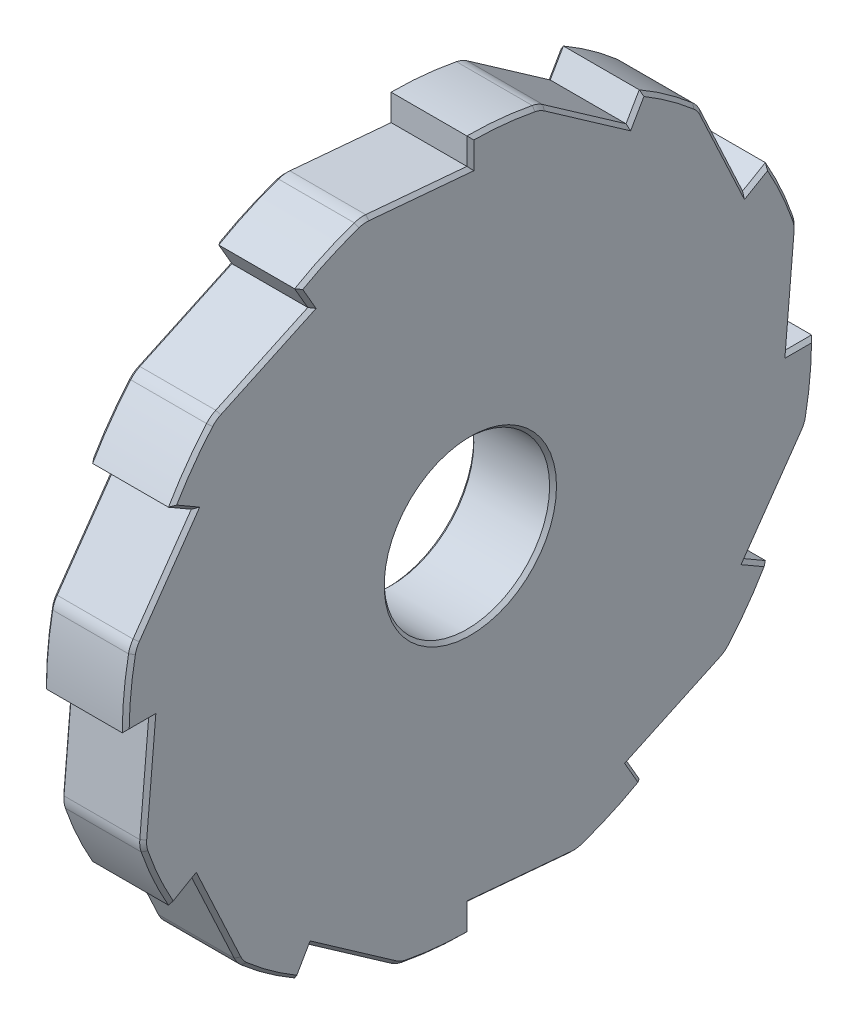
SolidWorks part; units mm, degrees
ref_plane "Спереди" through (0, 0, 0) normal (0, 0, 1) x (1, 0, 0)
ref_plane "Сверху" through (0, 0, 0) normal (0, 1, 0) x (1, 0, 0)
ref_plane "Справа" through (0, 0, 0) normal (1, 0, 0) x (0, 0, -1)
sketch "Эскиз1" plane through (0, 0, 0) normal (1, 0, 0) x (0, 0, -1)
  line L0 (0, 0) -> (0, 25) construction
  line L1 (5.5065, 24.2215) -> (11.5439, 19.9946)
  line L2 (0, 0) -> (12.5, 21.6506) construction
  line L3 (12.5, 21.6506) -> (11.5439, 19.9946)
  line L4 (16.8795, 18.2232) -> (19.9946, 11.5439)
  line L5 (21.6506, 12.5) -> (19.9946, 11.5439)
  line L6 (23.7296, 7.342) -> (23.0877, 0)
  line L7 (25, 0) -> (23.0877, 0)
  line L8 (24.2215, -5.5065) -> (19.9946, -11.5439)
  line L9 (21.6506, -12.5) -> (19.9946, -11.5439)
  line L10 (18.2232, -16.8795) -> (11.5439, -19.9946)
  line L11 (12.5, -21.6506) -> (11.5439, -19.9946)
  line L12 (7.342, -23.7296) -> (0, -23.0877)
  line L13 (0, -25) -> (0, -23.0877)
  line L14 (-5.5065, -24.2215) -> (-11.5439, -19.9946)
  line L15 (-12.5, -21.6506) -> (-11.5439, -19.9946)
  line L16 (-16.8795, -18.2232) -> (-19.9946, -11.5439)
  line L17 (-21.6506, -12.5) -> (-19.9946, -11.5439)
  line L18 (-23.7296, -7.342) -> (-23.0877, 0)
  line L19 (-25, 0) -> (-23.0877, 0)
  line L20 (-24.2215, 5.5065) -> (-19.9946, 11.5439)
  line L21 (-21.6506, 12.5) -> (-19.9946, 11.5439)
  line L22 (-18.2232, 16.8795) -> (-11.5439, 19.9946)
  line L23 (-12.5, 21.6506) -> (-11.5439, 19.9946)
  line L24 (-7.342, 23.7296) -> (0, 23.0877)
  line L25 (0, 25) -> (0, 23.0877)
  circle A0 centre (0, 0) radius 6
  arc A1 (4.7385, 24.5468) -> (0, 25) centre (0, 0) ccw
  arc A2 (5.5065, 24.2215) -> (4.7385, 24.5468) centre (4.3594, 22.5831) ccw
  arc A3 (16.3771, 18.8889) -> (12.5, 21.6506) centre (0, 0) ccw
  arc A4 (16.8795, 18.2232) -> (16.3771, 18.8889) centre (15.0669, 17.3778) ccw
  arc A5 (23.6274, 8.1698) -> (21.6506, 12.5) centre (0, 0) ccw
  arc A6 (23.7296, 7.342) -> (23.6274, 8.1698) centre (21.7372, 7.5162) ccw
  arc A7 (24.5468, -4.7385) -> (25, 0) centre (0, 0) ccw
  arc A8 (24.2215, -5.5065) -> (24.5468, -4.7385) centre (22.5831, -4.3594) ccw
  arc A9 (18.8889, -16.3771) -> (21.6506, -12.5) centre (0, 0) ccw
  arc A10 (18.2232, -16.8795) -> (18.8889, -16.3771) centre (17.3778, -15.0669) ccw
  arc A11 (8.1698, -23.6274) -> (12.5, -21.6506) centre (0, 0) ccw
  arc A12 (7.342, -23.7296) -> (8.1698, -23.6274) centre (7.5162, -21.7372) ccw
  arc A13 (-4.7385, -24.5468) -> (0, -25) centre (0, 0) ccw
  arc A14 (-5.5065, -24.2215) -> (-4.7385, -24.5468) centre (-4.3594, -22.5831) ccw
  arc A15 (-16.3771, -18.8889) -> (-12.5, -21.6506) centre (0, 0) ccw
  arc A16 (-16.8795, -18.2232) -> (-16.3771, -18.8889) centre (-15.0669, -17.3778) ccw
  arc A17 (-23.6274, -8.1698) -> (-21.6506, -12.5) centre (0, 0) ccw
  arc A18 (-23.7296, -7.342) -> (-23.6274, -8.1698) centre (-21.7372, -7.5162) ccw
  arc A19 (-24.5468, 4.7385) -> (-25, 0) centre (0, 0) ccw
  arc A20 (-24.2215, 5.5065) -> (-24.5468, 4.7385) centre (-22.5831, 4.3594) ccw
  arc A21 (-18.8889, 16.3771) -> (-21.6506, 12.5) centre (0, 0) ccw
  arc A22 (-18.2232, 16.8795) -> (-18.8889, 16.3771) centre (-17.3778, 15.0669) ccw
  arc A23 (-8.1698, 23.6274) -> (-12.5, 21.6506) centre (0, 0) ccw
  arc A24 (-7.342, 23.7296) -> (-8.1698, 23.6274) centre (-7.5162, 21.7372) ccw
  dimension "D1" = 12
  dimension "D2" = 50
  dimension "D6" = 2
  dimension "D3" = 23
  dimension "D4" = 30
  dimension "D5" = 1.905
  dimension "D7" = 12
extrude "Бобышка-Вытянуть1" add sketch "Эскиз1" along normal blind 6
chamfer "Фаска1" distance 0.25 angle 45 98 edges at (0, 0, -6) (0, 24.8864, -2.3801) (0, 24.0439, 0) (0, 23.4087, 3.671) (0, 23.7222, 7.7613) (0, 22.7423, 10.382) (0, 20.8226, 12.0219) (0, 18.437, 14.8835) (0, 16.6634, 18.5825) (0, 14.5044, 20.3623) (0, 12.0219, 20.8226) (0, 8.5252, 22.108) (0, 5.1396, 24.4246) (0, 2.3801, 24.8864) (0, 0, 24.0439) (0, -3.671, 23.4087) (0, -7.7613, 23.7222) (0, -10.382, 22.7423) (0, -12.0219, 20.8226) (0, -14.8835, 18.437) (0, -18.5825, 16.6634) (0, -20.3623, 14.5044) (0, -20.8226, 12.0219) (0, -22.108, 8.5252) (0, -24.4246, 5.1396) (0, -24.8864, 2.3801) (0, -24.0439, 0) (0, -23.4087, -3.671) (0, -23.7222, -7.7613) (0, -22.7423, -10.382) (0, -20.8226, -12.0219) (0, -18.437, -14.8835) (0, -16.6634, -18.5825) (0, -14.5044, -20.3623) (0, -12.0219, -20.8226) (0, -8.5252, -22.108) (0, -5.1396, -24.4246) (0, -2.3801, -24.8864) (0, 0, -24.0439) (0, 3.671, -23.4087) (0, 7.7613, -23.7222) (0, 10.382, -22.7423) (0, 12.0219, -20.8226) (0, 14.8835, -18.437) (0, 18.5825, -16.6634) (0, 20.3623, -14.5044) (0, 20.8226, -12.0219) (0, 22.108, -8.5252) (0, 24.4246, -5.1396) (6, 0, -6) (6, 22.108, -8.5252) (6, 20.8226, -12.0219) (6, 20.3623, -14.5044) (6, 18.5825, -16.6634) (6, 14.8835, -18.437) (6, 12.0219, -20.8226) (6, 10.382, -22.7423) (6, 7.7613, -23.7222) (6, 3.671, -23.4087) (6, 0, -24.0439) (6, -2.3801, -24.8864) (6, -5.1396, -24.4246) (6, -8.5252, -22.108) (6, -12.0219, -20.8226) (6, -14.5044, -20.3623) (6, -16.6634, -18.5825) (6, -18.437, -14.8835) (6, -20.8226, -12.0219) (6, -22.7423, -10.382) (6, -23.7222, -7.7613) (6, -23.4087, -3.671) (6, -24.0439, 0) (6, -24.8864, 2.3801) (6, -24.4246, 5.1396) (6, -22.108, 8.5252) (6, -20.8226, 12.0219) (6, -20.3623, 14.5044) (6, -18.5825, 16.6634) (6, -14.8835, 18.437) (6, -12.0219, 20.8226) (6, -10.382, 22.7423) (6, -7.7613, 23.7222) (6, -3.671, 23.4087) (6, 0, 24.0439) (6, 2.3801, 24.8864) (6, 5.1396, 24.4246) (6, 8.5252, 22.108) (6, 12.0219, 20.8226) (6, 14.5044, 20.3623) (6, 16.6634, 18.5825) (6, 18.437, 14.8835) (6, 20.8226, 12.0219) (6, 22.7423, 10.382) (6, 23.7222, 7.7613) (6, 23.4087, 3.671) (6, 24.0439, 0) (6, 24.8864, -2.3801) (6, 24.4246, -5.1396)
